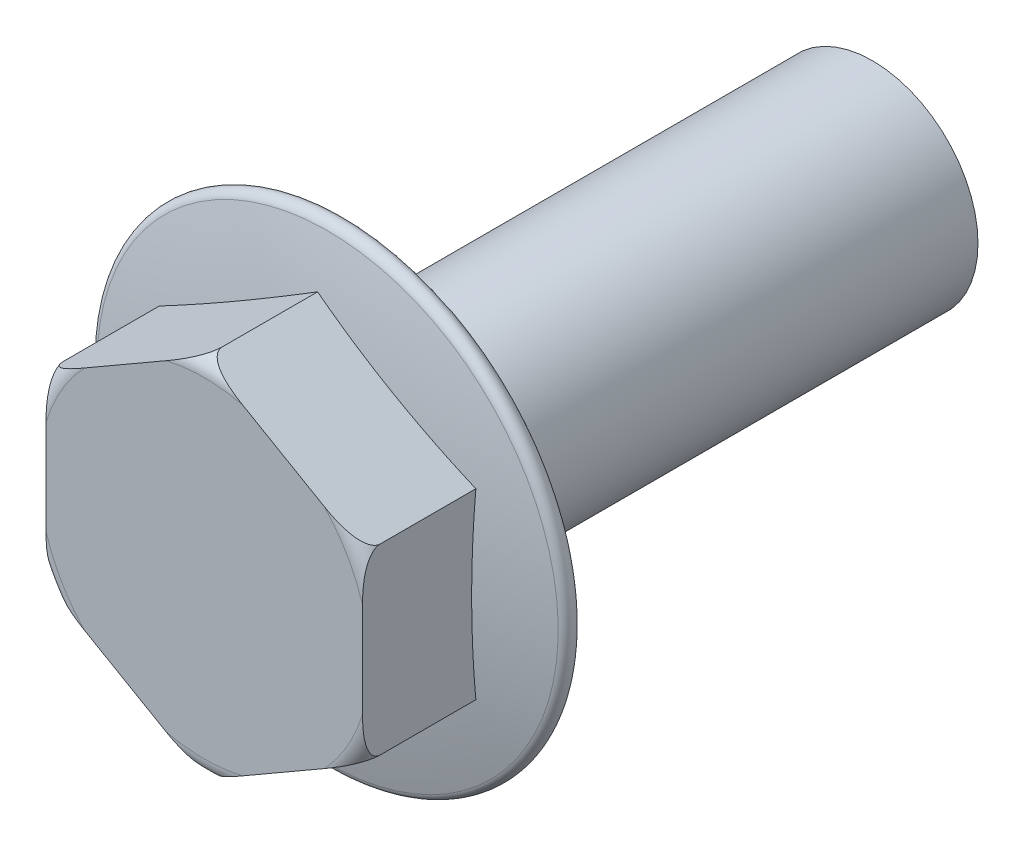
SolidWorks part; units mm, degrees
extrude "Head" add sketch "Head Sketch" along normal blind 8
sketch "Head Sketch" plane through (0, 0, 0) normal (0, 0, 1) x (1, 0, 0)
  line L0 (0, 10.3923) -> (9, 5.1962)
  line L1 (9, 5.1962) -> (9, -5.1962)
  line L2 (9, -5.1962) -> (0, -10.3923)
  line L3 (0, -10.3923) -> (-9, -5.1962)
  line L4 (-9, -5.1962) -> (-9, 5.1962)
  line L5 (-9, 5.1962) -> (0, 10.3923)
  line L6 (9, 5.1962) -> (-9, -5.1962) construction
  line L7 (0, 10.3923) -> (0, -10.3923) construction
  line L8 (-9, 5.1962) -> (9, -5.1962) construction
  point P0 (0, 0)
  dimension "D1" = 60
  dimension "D2" = 60
  dimension "Flats" = 18
revolve "Flange" add sketch "Flange Sketch" angle 360 about L0
sketch "Flange Sketch" plane through (0, 0, 0) normal (0, 1, 0) x (-1, 0, 0)
  line L0 (0, 1.8434) -> (0, 2.5) construction
  line L1 (-13, 0) -> (0, 0)
  line L2 (0, 50) -> (0, -50) construction
  line L4 (0, 0) -> (0, 2.5)
  line L5 (0, 0) -> (-9, 0) construction
  arc A0 (0, 2.5) -> (-13.1139, 0.9869) centre (0, -55.0833) ccw
  arc A1 (-13, 0) -> (-13.1139, 0.9869) centre (-13, 0.5) cw
  dimension "D1" = 0.5
  dimension "D3" = 26
  dimension "Flange Height" = 2.5
ref_plane "Plane1" through (0, 0, 0) normal (0, 0, 1) x (1, 0, 0)
ref_plane "Plane2" through (0, 0, 0) normal (0, 1, 0) x (-1, 0, 0)
ref_plane "Plane3" through (0, 0, 0) normal (1, 0, 0) x (0, 0, -1)
sketch "Sketch5" plane through (0, 0, 0) normal (1, 0, 0) x (0, 0, -1)
  line L0 (-8, -9.3923) -> (-8, -10.3923)
  line L1 (-8, -10.3923) -> (-7, -10.3923)
  line L2 (-8, -10.3923) -> (-1.5545, -10.3923) construction
  line L3 (-8, -10.3923) -> (-8, -5.1962) construction
  line L5 (-15.0856, 0) -> (-8.1394, 0) construction
  line L6 (50, 0) -> (-50, 0) construction
  arc A0 (-8, -9.3923) -> (-7, -10.3923) centre (-7, -9.3923) ccw
  dimension "D1" = 1
revolve "Head Trim" cut sketch "Sketch5" angle 360 about L5
sketch "Esquisse1" plane through (0, 0, 0) normal (0, 0, -1) x (-1, 0, 0)
  circle A0 centre (0, 0) radius 6
  dimension "D1" = 12
extrude "Boss.-Extru.1" add sketch "Esquisse1" along normal blind 30
